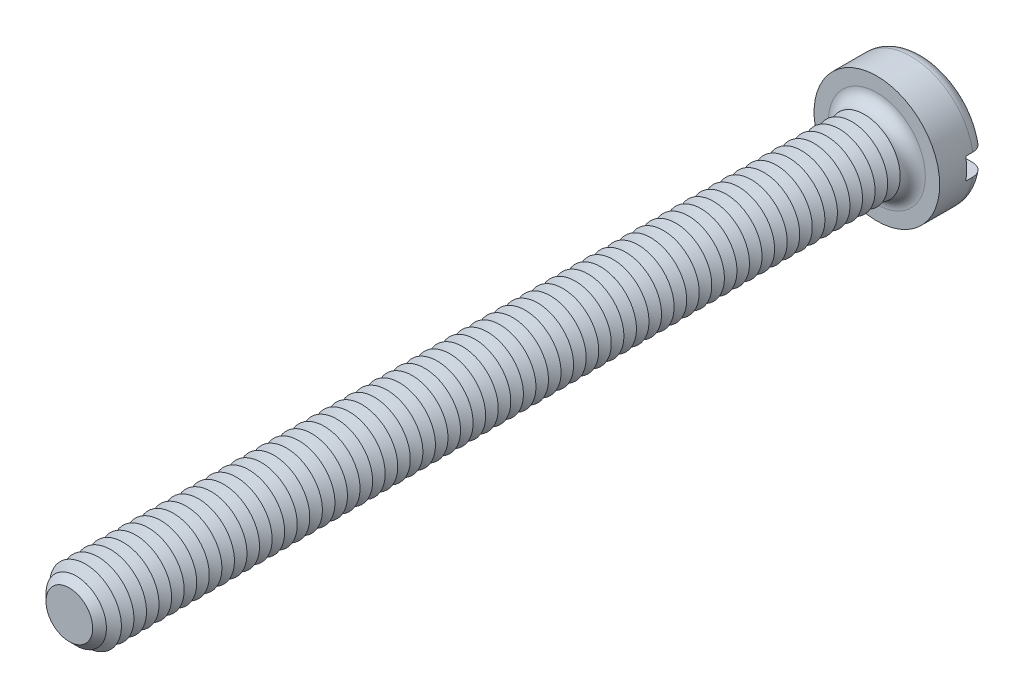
SolidWorks part; units mm, degrees
ref_plane "Front Plane" through (0, 0, 0) normal (0, 0, 1) x (1, 0, 0)
ref_plane "Top Plane" through (0, 0, 0) normal (0, 1, 0) x (1, 0, 0)
ref_plane "Right Plane" through (0, 0, 0) normal (1, 0, 0) x (0, 0, -1)
sketch "Sketch3" plane through (0, 0, 0) normal (0, 0, 1) x (1, 0, 0)
  circle A0 centre (0, 0) radius 3.5
  dimension "D1" = 7
extrude "Boss-Extrude2" add sketch "Sketch3" against normal blind 2.6
sketch "Sketch4" plane through (0, 0, 0) normal (0, 0, 1) x (1, 0, 0)
  circle A0 centre (0, 0) radius 2
  dimension "D1" = 4
extrude "Boss-Extrude3" add sketch "Sketch4" along normal blind 45
fillet "Fillet1" radius 0.7 2 edges at (3.5, 0, -2.6) (2, 0, 0)
chamfer "Chamfer1" distance 0.7 angle 45 1 edges at (2, 0, 45)
sketch "Sketch5" plane through (0, 0, 0) normal (1, 0, 0) x (0, 0, -1)
  line L0 (1.6944, 0) -> (-7.6738, 0) construction
sketch "Sketch6" plane through (0, 0, 0) normal (1, 0, 0) x (0, 0, -1)
  line L0 (-0.7, 2) -> (-1.05, 1.3938)
  line L1 (-1.05, 1.3938) -> (-1.4, 2)
  line L2 (-0.7, 2) -> (-44.3, 2) construction
  line L3 (-1.4, 2) -> (-0.7, 2)
  dimension "D1" = 0.7
revolve "Cut-Revolve1" cut sketch "Sketch6" angle 360 about L0
pattern_linear "LPattern1" count 63 spacing 0.7 along (0, 0, 1) of "Cut-Revolve1"
sketch "Sketch8" plane through (0, 0, -2.6) normal (0, 0, -1) x (-1, 0, 0)
  line L1 (3.5, -0.6) -> (-3.5, -0.6)
  line L2 (3.5, -0.6) -> (3.5, 0.6)
  line L3 (3.5, 0.6) -> (-3.5, 0.6)
  line L4 (-3.5, -0.6) -> (-3.5, 0.6)
  line L5 (3.5, -0.6) -> (-3.5, 0.6) construction
  line L6 (3.5, 0.6) -> (-3.5, -0.6) construction
  point P0 (0, 0)
  dimension "D1" = 7
  dimension "D2" = 1.2
extrude "Cut-Extrude1" cut sketch "Sketch8" against normal blind 1.1
